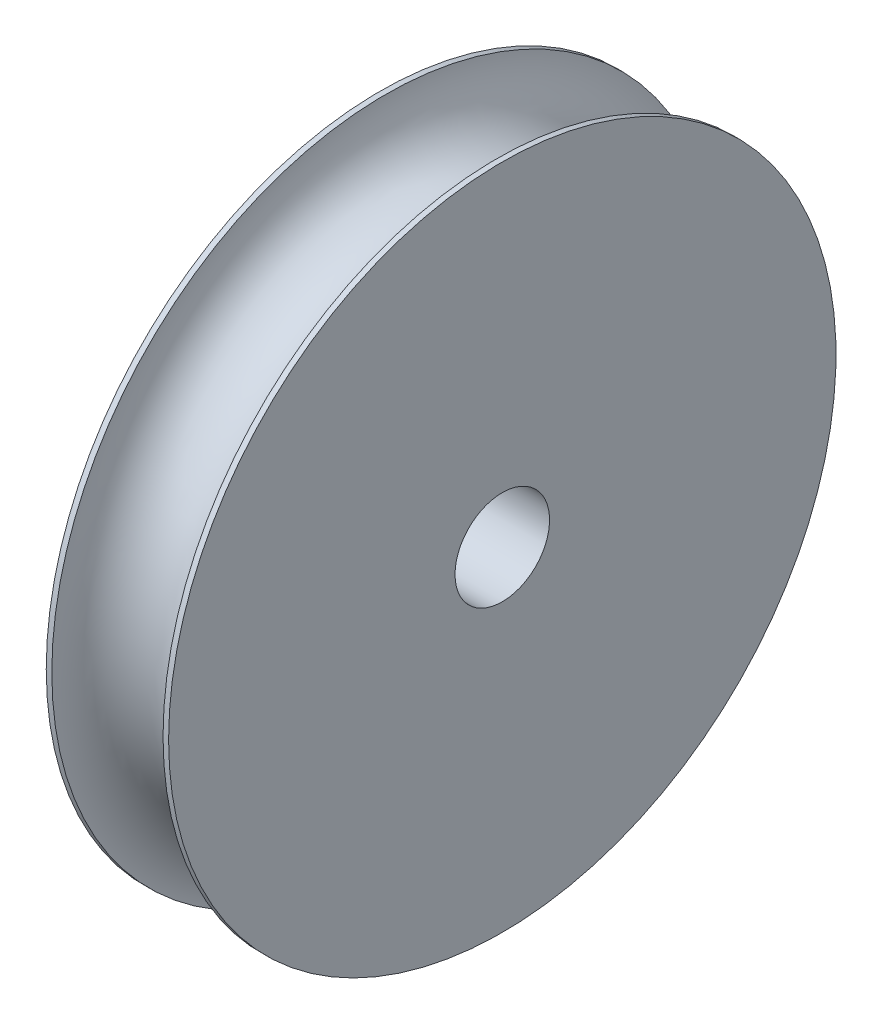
SolidWorks part; units mm, degrees
ref_plane "Plan de face" through (0, 0, 0) normal (0, 0, 1) x (1, 0, 0)
ref_plane "Plan de dessus" through (0, 0, 0) normal (0, 1, 0) x (1, 0, 0)
ref_plane "Plan de droite" through (0, 0, 0) normal (1, 0, 0) x (0, 0, -1)
sketch "Esquisse1" plane through (0, 0, 0) normal (0, 0, 1) x (1, 0, 0)
  line L0 (0, 0) -> (91.9944, 0) construction
  line L1 (0, 17) -> (0, 120)
  line L2 (44, 120) -> (44, 17)
  line L3 (0, 120) -> (2, 120)
  line L4 (42, 120) -> (44, 120)
  line L6 (0, 17) -> (44, 17)
  arc A0 (2, 120) -> (42, 120) centre (22, 120) ccw
  point P12 (6.6869, 8.9761)
  dimension "D1" = 44
  dimension "D2" = 120
  dimension "D3" = 34
  dimension "D4" = 2
  dimension "D5" = 2
revolve "Révolution1" add sketch "Esquisse1" angle 360 about L0
